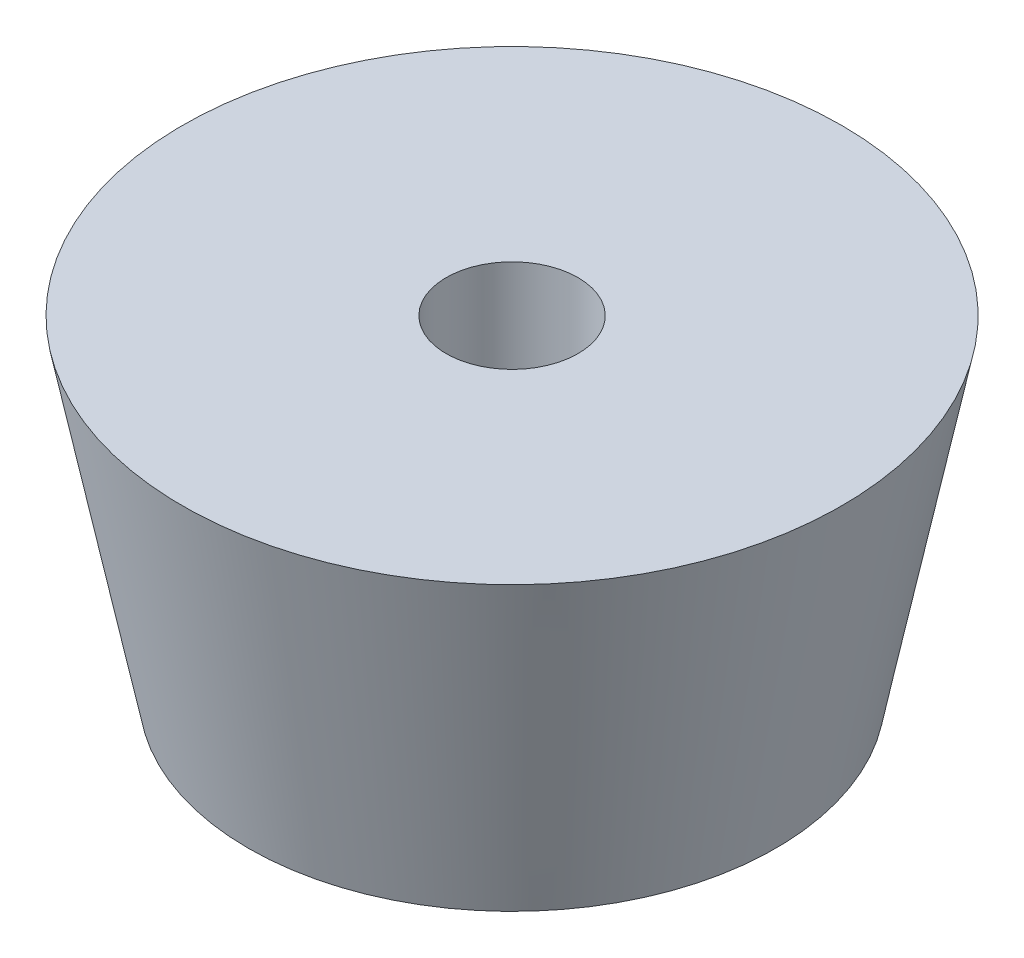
SolidWorks part; units mm, degrees
ref_plane "Front Plane" through (0, 0, 0) normal (0, 0, 1) x (1, 0, 0)
ref_plane "Top Plane" through (0, 0, 0) normal (0, 1, 0) x (1, 0, 0)
ref_plane "Right Plane" through (0, 0, 0) normal (1, 0, 0) x (0, 0, -1)
sketch "Sketch1" plane through (0, 0, 0) normal (1, 0, 0) x (0, 0, -1)
  line L0 (0, 0) -> (0, 18.4978) construction
  line L1 (-3.175, 15.875) -> (-3.175, 0)
  line L4 (-3.175, 0) -> (-12.7, 0)
  line L5 (-12.7, 0) -> (-15.875, 15.875)
  line L6 (-15.875, 15.875) -> (-3.175, 15.875)
  point P5 (-3.175, 0)
  point P6 (-3.4451, 0)
  dimension "D1" = 3.175
  dimension "D2" = 15.875
  dimension "D3" = 12.7
  dimension "D4" = 15.875
revolve "Revolve1" add sketch "Sketch1" angle 360 about L0
sketch "Sketch3" plane through (0, 0, 0) normal (0, -1, 0) x (1, 0, 0)
  line L0 (0, 0) -> (0, 5.715) construction
  line L1 (-2.794, 5.715) -> (2.794, 5.715) construction
  line L2 (0, 0) -> (4.9493, 2.8575) construction
  line L3 (3.2996, 5.715) -> (6.5991, 0) construction
  line L4 (0, 0) -> (4.9493, -2.8575) construction
  line L5 (6.5991, 0) -> (3.2996, -5.715) construction
  line L6 (0, 0) -> (0, -5.715) construction
  line L7 (3.2996, -5.715) -> (-3.2996, -5.715) construction
  line L8 (0, 0) -> (-4.9493, -2.8575) construction
  line L9 (-3.2996, -5.715) -> (-6.5991, 0) construction
  line L10 (0, 0) -> (-4.9493, 2.8575) construction
  line L11 (-6.5991, 0) -> (-3.4266, 5.495) construction
  line L12 (-3.2996, 5.715) -> (0, 0) construction
  line L13 (3.2996, 5.715) -> (0, 0) construction
  line L14 (6.5991, 0) -> (0, 0) construction
  line L15 (3.2996, -5.715) -> (0, 0) construction
  line L16 (-3.2996, -5.715) -> (0, 0) construction
  line L17 (-6.5991, 0) -> (0, 0) construction
  line L18 (-6.4721, 0.22) -> (-3.4266, 5.495)
  line L19 (-3.0456, 5.715) -> (3.0456, 5.715)
  line L20 (0, 0) -> (0, 5.715) construction
  line L21 (3.4266, 5.495) -> (6.4721, 0.22)
  line L22 (0, 0) -> (4.9493, 2.8575) construction
  line L23 (6.4721, -0.22) -> (3.4266, -5.495)
  line L24 (0, 0) -> (4.9493, -2.8575) construction
  line L25 (3.0456, -5.715) -> (-3.0456, -5.715)
  line L26 (0, 0) -> (0, -5.715) construction
  line L27 (-3.4266, -5.495) -> (-6.4721, -0.22)
  line L28 (0, 0) -> (-4.9493, -2.8575) construction
  arc A0 (-3.0456, 5.715) -> (-3.4266, 5.495) centre (-3.2996, 5.715) ccw
  arc A1 (3.4266, 5.495) -> (3.0456, 5.715) centre (3.2996, 5.715) ccw
  arc A2 (6.4721, -0.22) -> (6.4721, 0.22) centre (6.5991, 0) ccw
  arc A3 (3.0456, -5.715) -> (3.4266, -5.495) centre (3.2996, -5.715) ccw
  arc A4 (-3.4266, -5.495) -> (-3.0456, -5.715) centre (-3.2996, -5.715) ccw
  arc A5 (-6.4721, 0.22) -> (-6.4721, -0.22) centre (-6.5991, 0) ccw
  point P6 (-3.2997, 5.2068)
  dimension "D4" = 0.508
  dimension "D1" = 5.715
  dimension "D2" = 5.588
  dimension "D3" = 6
  dimension "D5" = 6
  dimension "D6" = 6
extrude "Cut-Extrude1" cut sketch "Sketch3" against normal blind 8.255
